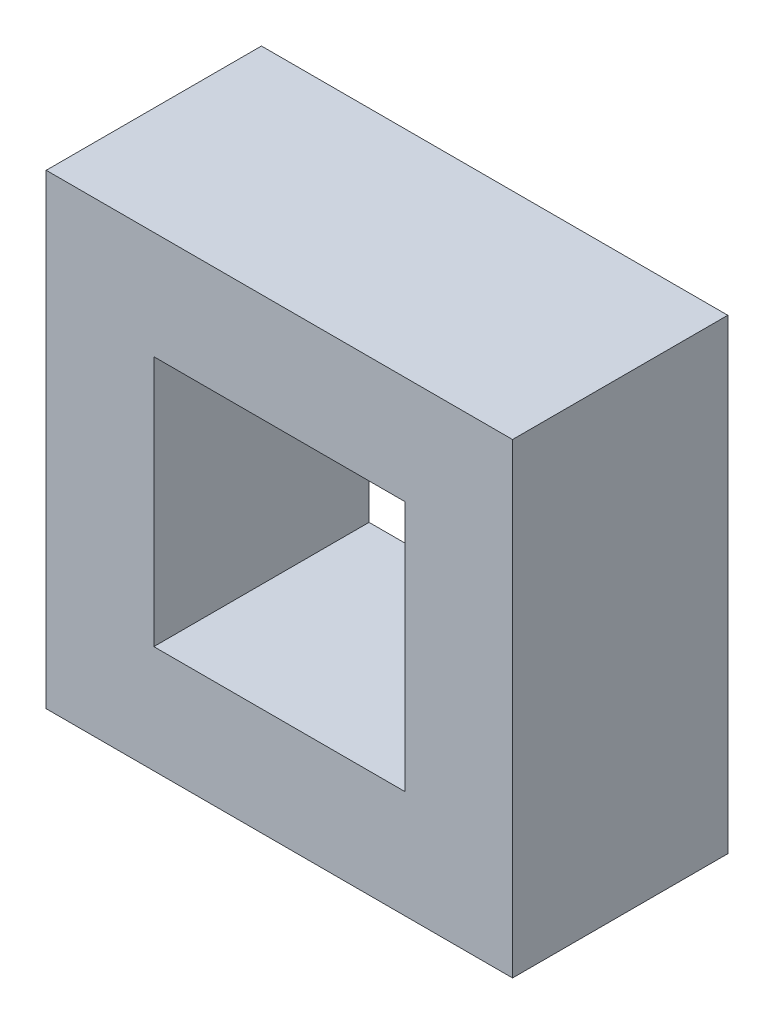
SolidWorks part; units mm, degrees
ref_plane "Front Plane" through (0, 0, 0) normal (0, 0, 1) x (1, 0, 0)
ref_plane "Top Plane" through (0, 0, 0) normal (0, 1, 0) x (1, 0, 0)
ref_plane "Right Plane" through (0, 0, 0) normal (1, 0, 0) x (0, 0, -1)
sketch "Sketch2" plane through (0, 0, 0) normal (0, 0, 1) x (1, 0, 0)
  line L1 (-330.2, 330.2) -> (330.2, 330.2)
  line L2 (-330.2, 330.2) -> (-330.2, -330.2)
  line L3 (-330.2, -330.2) -> (330.2, -330.2)
  line L4 (330.2, 330.2) -> (330.2, -330.2)
  line L5 (-330.2, 330.2) -> (330.2, -330.2) construction
  line L6 (-330.2, -330.2) -> (330.2, 330.2) construction
  line L7 (-177.8, 177.8) -> (177.8, 177.8)
  line L8 (-177.8, 177.8) -> (-177.8, -177.8)
  line L9 (-177.8, -177.8) -> (177.8, -177.8)
  line L10 (177.8, 177.8) -> (177.8, -177.8)
  line L11 (-177.8, 177.8) -> (177.8, -177.8) construction
  line L12 (-177.8, -177.8) -> (177.8, 177.8) construction
  point P0 (0, 0)
  point P6 (0, 0)
  dimension "D1" = 660.4
  dimension "D2" = 660.4
  dimension "D3" = 355.6
extrude "Extrude1" add sketch "Sketch2" along normal blind 304.8
